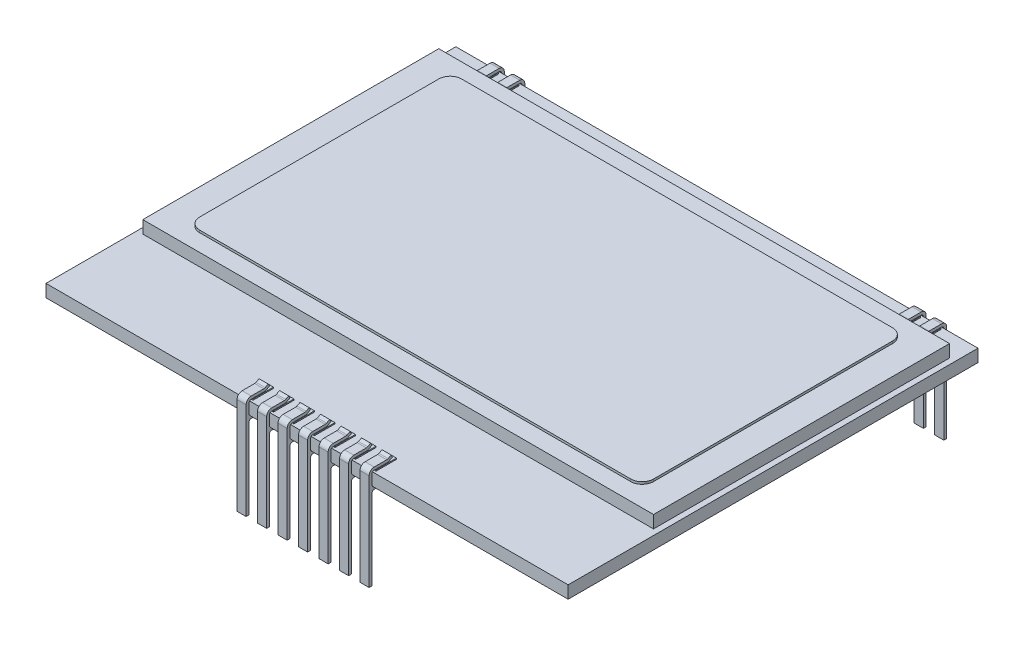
SolidWorks part; units mm, degrees
ref_plane "Front" through (0, 0, 0) normal (0, 0, 1) x (1, 0, 0)
ref_plane "Top" through (0, 0, 0) normal (0, 1, 0) x (1, 0, 0)
ref_plane "Right" through (0, 0, 0) normal (1, 0, 0) x (0, 0, -1)
sketch "Эскиз1" plane through (0, 0, 0) normal (0, 1, 0) x (1, 0, 0)
  line L1 (-22.93, -18) -> (22.93, -18)
  line L2 (-22.93, -18) -> (-22.93, 18)
  line L3 (-22.93, 18) -> (22.93, 18)
  line L4 (22.93, -18) -> (22.93, 18)
  line L5 (-22.93, -18) -> (22.93, 18) construction
  line L6 (-22.93, 18) -> (22.93, -18) construction
  point P0 (0, 0)
  dimension "D1" = 45.86
  dimension "D2" = 36
extrude "Вытянуть1" add sketch "Эскиз1" along normal blind 1.1 from offset 5
sketch "Эскиз2" plane through (0, 6.1, 0) normal (0, 1, 0) x (1, 0, 0)
  line L0 (-22.93, 18) -> (-22.93, -18) construction
  line L1 (22.43, -10) -> (-22.43, -10)
  line L2 (22.43, -10) -> (22.43, 16)
  line L3 (22.43, 16) -> (-22.43, 16)
  line L4 (-22.43, -10) -> (-22.43, 16)
  line L5 (22.43, -10) -> (-22.43, 16) construction
  line L6 (22.43, 16) -> (-22.43, -10) construction
  line L7 (-22.93, -18) -> (22.93, -18) construction
  point P0 (0, 3)
  dimension "D1" = 0.5
  dimension "D2" = 26
  dimension "D3" = 8
extrude "Вытянуть2" add sketch "Эскиз2" along normal blind 1.1
sketch "Эскиз3" plane through (0, 7.2, 0) normal (0, 1, 0) x (1, 0, 0)
  line L1 (-18.93, 14.5) -> (18.93, 14.5)
  line L2 (-19.93, 13.5) -> (-19.93, -7.5)
  line L3 (-18.93, -8.5) -> (18.93, -8.5)
  line L4 (19.93, 13.5) -> (19.93, -7.5)
  line L5 (-19.93, 14.5) -> (19.93, -8.5) construction
  line L6 (-19.93, -8.5) -> (19.93, 14.5) construction
  arc A0 (-18.93, 14.5) -> (-19.93, 13.5) centre (-18.93, 13.5) ccw
  arc A1 (18.93, 14.5) -> (19.93, 13.5) centre (18.93, 13.5) cw
  arc A2 (18.93, -8.5) -> (19.93, -7.5) centre (18.93, -7.5) ccw
  arc A3 (-19.93, -7.5) -> (-18.93, -8.5) centre (-18.93, -7.5) ccw
  point P0 (0, 3)
  dimension "D3" = 1
  dimension "D1" = 39.86
  dimension "D2" = 23
extrude "Вытянуть3" add sketch "Эскиз3" along normal blind 0.2
sketch "Эскиз4" plane through (0, 6.1, 0) normal (0, 1, 0) x (1, 0, 0)
  line L1 (-19.43, 16) -> (-19.43, 17.8) construction
  line L2 (-22.93, 18) -> (-22.93, -18) construction
  line L3 (-5.4, -17.8) -> (-5.4, -16) construction
  line L4 (-22.93, -18) -> (22.93, -18) construction
  line L5 (22.43, 16) -> (-22.43, 16) construction
  line L6 (-5.85, -17.8) -> (-4.95, -17.8)
  line L7 (-5.85, -17.8) -> (-5.85, -16)
  line L8 (-5.85, -16) -> (-4.95, -16)
  line L9 (-4.95, -17.8) -> (-4.95, -16)
  line L10 (-19.88, 16) -> (-18.98, 16)
  line L11 (-19.88, 16) -> (-19.88, 17.8)
  line L12 (-19.88, 17.8) -> (-18.98, 17.8)
  line L13 (-18.98, 16) -> (-18.98, 17.8)
  line L14 (22.93, 18) -> (-22.93, 18) construction
  line L15 (-3.15, -17.8) -> (-3.15, -16)
  line L16 (-4.05, -16) -> (-3.15, -16)
  line L17 (-4.05, -17.8) -> (-4.05, -16)
  line L18 (-4.05, -17.8) -> (-3.15, -17.8)
  line L19 (-1.35, -17.8) -> (-1.35, -16)
  line L20 (-2.25, -16) -> (-1.35, -16)
  line L21 (-2.25, -17.8) -> (-2.25, -16)
  line L22 (-2.25, -17.8) -> (-1.35, -17.8)
  line L23 (0.45, -17.8) -> (0.45, -16)
  line L24 (-0.45, -16) -> (0.45, -16)
  line L25 (-0.45, -17.8) -> (-0.45, -16)
  line L26 (-0.45, -17.8) -> (0.45, -17.8)
  line L27 (2.25, -17.8) -> (2.25, -16)
  line L28 (1.35, -16) -> (2.25, -16)
  line L29 (1.35, -17.8) -> (1.35, -16)
  line L30 (1.35, -17.8) -> (2.25, -17.8)
  line L31 (4.05, -17.8) -> (4.05, -16)
  line L32 (3.15, -16) -> (4.05, -16)
  line L33 (3.15, -17.8) -> (3.15, -16)
  line L34 (3.15, -17.8) -> (4.05, -17.8)
  line L35 (5.85, -17.8) -> (5.85, -16)
  line L36 (4.95, -16) -> (5.85, -16)
  line L37 (4.95, -17.8) -> (4.95, -16)
  line L38 (4.95, -17.8) -> (5.85, -17.8)
  line L39 (-18.08, 16) -> (-18.08, 17.8)
  line L41 (-18.08, 16) -> (-17.18, 16)
  line L42 (-18.08, 17.8) -> (-17.18, 17.8)
  line L43 (-17.18, 16) -> (-17.18, 17.8)
  line L44 (17.18, 16) -> (18.08, 16)
  line L45 (17.18, 16) -> (17.18, 17.8)
  line L46 (17.18, 17.8) -> (18.08, 17.8)
  line L47 (18.08, 16) -> (18.08, 17.8)
  line L48 (18.98, 16) -> (18.98, 17.8)
  line L49 (18.98, 16) -> (19.88, 16)
  line L50 (18.98, 17.8) -> (19.88, 17.8)
  line L51 (19.88, 16) -> (19.88, 17.8)
  line L52 (17.63, 16) -> (17.63, 17.8) construction
  line L53 (22.43, 16) -> (-22.43, 16) construction
  line L54 (5.4, -17.8) -> (5.4, -16) construction
  line L55 (22.93, -18) -> (22.93, 18) construction
  line L56 (19.43, 17.8) -> (19.43, 16) construction
  dimension "D1" = 0.9
  dimension "D2" = 1.8
  dimension "D3" = 3.5
  dimension "D4" = 17.53
  dimension "D5" = 0.2
  dimension "D6" = 0.2
  dimension "D7" = 1.8
  dimension "D8" = 1.8
  dimension "D9" = 35.26
  dimension "D10" = 17.53
  dimension "D11" = 3.5
extrude "Вытянуть4" add sketch "Эскиз4" along normal blind 0.1
sketch "Эскиз5" plane through (0, 0, 0) normal (1, 0, 0) x (0, 0, -1)
  line L0 (-18.1, 5.2) -> (-18.1, 6)
  line L1 (-17.9, 6.2) -> (-16.8, 6.2)
  line L2 (-16.5647, 6.2588) -> (-16.3, 6.4)
  line L3 (-18.1, 5.6) -> (-17.2147, 5.6) construction
  line L4 (-16.5647, 4.9412) -> (-16.3, 4.8)
  line L5 (-17.9, 5) -> (-16.8, 5)
  line L6 (-16, 6.2) -> (-16, 6.1) construction
  line L7 (-16, 6.2) -> (-16, 6.1) construction
  line L8 (-17.8, 6.2) -> (-16, 6.2) construction
  line L9 (-18, 5) -> (18, 5) construction
  line L10 (-18, 6.1) -> (-18, 5) construction
  line L11 (-16.6824, 4.7206) -> (-16.4176, 4.5794)
  line L12 (-17.9, 4.75) -> (-16.8, 4.75)
  line L13 (-18.35, 5.2) -> (-18.35, 6)
  line L14 (-17.9, 6.45) -> (-16.8, 6.45)
  line L15 (-16.6824, 6.4794) -> (-16.4176, 6.6206)
  line L16 (-16.3, 6.4) -> (-16.4176, 6.6206)
  line L17 (-16.4176, 4.5794) -> (-16.3, 4.8)
  line L18 (-18.35, 5.2) -> (-18.35, -2.5)
  line L19 (-18.35, -2.5) -> (-18.1, -2.5)
  line L20 (-18.1, -2.5) -> (-18.1, 4.55)
  line L21 (-17.9, 4.75) -> (-16.8, 4.75) construction
  arc A0 (-16.8, 6.2) -> (-16.5647, 6.2588) centre (-16.8, 6.7) ccw
  arc A1 (-18.1, 6) -> (-17.9, 6.2) centre (-17.9, 6) cw
  arc A2 (-18.1, 5.2) -> (-17.9, 5) centre (-17.9, 5.2) ccw
  arc A3 (-16.8, 5) -> (-16.5647, 4.9412) centre (-16.8, 4.5) cw
  arc A4 (-16.8, 4.75) -> (-16.6824, 4.7206) centre (-16.8, 4.5) cw
  arc A5 (-17.9, 4.75) -> (-18.1, 4.55) centre (-17.9, 4.55) ccw
  arc A6 (-18.35, 6) -> (-17.9, 6.45) centre (-17.9, 6) cw
  arc A7 (-16.8, 6.45) -> (-16.6824, 6.4794) centre (-16.8, 6.7) ccw
  arc A9 (-18.35, 5.2) -> (-17.9, 4.75) centre (-17.9, 5.2) ccw construction
  dimension "D1" = 0.5
  dimension "D2" = 0.2
  dimension "D8" = 0.2
  dimension "D3" = 0.3
  dimension "D4" = 0.2
  dimension "D5" = 0.8
  dimension "D6" = 0.1
  dimension "D9" = 7.5
  dimension "D7" = 0.25
extrude "Вытянуть5" add sketch "Эскиз5" along normal mid plane 0.8 from offset 5.4
sketch "Эскиз6" plane through (0, 0, 0) normal (1, 0, 0) x (0, 0, -1)
  line L0 (0, 0) -> (0, 5) construction
  line L1 (-18, 5) -> (18, 5) construction
  line L2 (18.1, -2.5) -> (18.1, 4.55)
  line L3 (18.35, -2.5) -> (18.1, -2.5)
  line L4 (18.35, 5.2) -> (18.35, -2.5)
  line L5 (18.35, 6) -> (18.35, 5.2)
  line L6 (16.8, 6.45) -> (17.9, 6.45)
  line L7 (16.4176, 6.6206) -> (16.6824, 6.4794)
  line L8 (16.3, 6.4) -> (16.4176, 6.6206)
  line L9 (16.5647, 6.2588) -> (16.3, 6.4)
  line L10 (17.9, 6.2) -> (16.8, 6.2)
  line L11 (18.1, 5.2) -> (18.1, 6)
  line L12 (16.8, 5) -> (17.9, 5)
  line L13 (16.3, 4.8) -> (16.5647, 4.9412)
  line L14 (16.4176, 4.5794) -> (16.3, 4.8)
  line L15 (16.6824, 4.7206) -> (16.4176, 4.5794)
  line L16 (17.9, 4.75) -> (16.8, 4.75)
  line L17 (-17.9, 4.75) -> (-16.8, 4.75)
  line L18 (-16.6824, 4.7206) -> (-16.4176, 4.5794)
  line L19 (-16.4176, 4.5794) -> (-16.3, 4.8)
  line L20 (-16.3, 4.8) -> (-16.5647, 4.9412)
  line L21 (-16.8, 5) -> (-17.9, 5)
  line L22 (-18.1, 5.2) -> (-18.1, 6)
  line L23 (-17.9, 6.2) -> (-16.8, 6.2)
  line L24 (-16.5647, 6.2588) -> (-16.3, 6.4)
  line L25 (-16.3, 6.4) -> (-16.4176, 6.6206)
  line L26 (-16.4176, 6.6206) -> (-16.6824, 6.4794)
  line L27 (-16.8, 6.45) -> (-17.9, 6.45)
  line L28 (-18.35, 6) -> (-18.35, 5.2)
  line L29 (-18.35, 5.2) -> (-18.35, -2.5)
  line L30 (-18.35, -2.5) -> (-18.1, -2.5)
  line L31 (-18.1, -2.5) -> (-18.1, 4.55)
  line L32 (-17.9, 4.75) -> (-16.8, 4.75) construction
  line L33 (-16.6824, 4.7206) -> (-16.4176, 4.5794) construction
  line L34 (-16.4176, 4.5794) -> (-16.3, 4.8) construction
  line L35 (-16.3, 4.8) -> (-16.5647, 4.9412) construction
  line L36 (-16.8, 5) -> (-17.9, 5) construction
  line L37 (-18.1, 5.2) -> (-18.1, 6) construction
  line L38 (-17.9, 6.2) -> (-16.8, 6.2) construction
  line L39 (-16.5647, 6.2588) -> (-16.3, 6.4) construction
  line L40 (-16.3, 6.4) -> (-16.4176, 6.6206) construction
  line L41 (-16.4176, 6.6206) -> (-16.6824, 6.4794) construction
  line L42 (-16.8, 6.45) -> (-17.9, 6.45) construction
  line L43 (-18.35, 6) -> (-18.35, 5.2) construction
  line L44 (-18.35, 5.2) -> (-18.35, -2.5) construction
  line L45 (-18.35, -2.5) -> (-18.1, -2.5) construction
  line L46 (-18.1, -2.5) -> (-18.1, 4.55) construction
  arc A0 (17.9, 4.75) -> (18.1, 4.55) centre (17.9, 4.55) cw
  arc A1 (17.9, 6.45) -> (18.35, 6) centre (17.9, 6) cw
  arc A2 (16.8, 6.45) -> (16.6824, 6.4794) centre (16.8, 6.7) cw
  arc A3 (16.8, 6.2) -> (16.5647, 6.2588) centre (16.8, 6.7) cw
  arc A4 (17.9, 6.2) -> (18.1, 6) centre (17.9, 6) cw
  arc A5 (18.1, 5.2) -> (17.9, 5) centre (17.9, 5.2) cw
  arc A6 (16.5647, 4.9412) -> (16.8, 5) centre (16.8, 4.5) cw
  arc A7 (16.6824, 4.7206) -> (16.8, 4.75) centre (16.8, 4.5) cw
  arc A8 (-16.6824, 4.7206) -> (-16.8, 4.75) centre (-16.8, 4.5) ccw
  arc A9 (-16.5647, 4.9412) -> (-16.8, 5) centre (-16.8, 4.5) ccw
  arc A10 (-18.1, 5.2) -> (-17.9, 5) centre (-17.9, 5.2) ccw
  arc A11 (-17.9, 6.2) -> (-18.1, 6) centre (-17.9, 6) ccw
  arc A12 (-16.8, 6.2) -> (-16.5647, 6.2588) centre (-16.8, 6.7) ccw
  arc A13 (-16.8, 6.45) -> (-16.6824, 6.4794) centre (-16.8, 6.7) ccw
  arc A14 (-17.9, 6.45) -> (-18.35, 6) centre (-17.9, 6) ccw
  arc A15 (-17.9, 4.75) -> (-18.1, 4.55) centre (-17.9, 4.55) ccw
  arc A16 (-16.6824, 4.7206) -> (-16.8, 4.75) centre (-16.8, 4.5) ccw construction
  arc A17 (-16.5647, 4.9412) -> (-16.8, 5) centre (-16.8, 4.5) ccw construction
  arc A18 (-18.1, 5.2) -> (-17.9, 5) centre (-17.9, 5.2) ccw construction
  arc A19 (-17.9, 6.2) -> (-18.1, 6) centre (-17.9, 6) ccw construction
  arc A20 (-16.8, 6.2) -> (-16.5647, 6.2588) centre (-16.8, 6.7) ccw construction
  arc A21 (-16.8, 6.45) -> (-16.6824, 6.4794) centre (-16.8, 6.7) ccw construction
  arc A22 (-17.9, 6.45) -> (-18.35, 6) centre (-17.9, 6) ccw construction
  arc A23 (-17.9, 4.75) -> (-18.1, 4.55) centre (-17.9, 4.55) ccw construction
  dimension "D1" = 0
extrude "Вытянуть6" add sketch "Эскиз6" along normal mid plane 0.8 from offset 19.43
pattern_linear "Линейный массив1" count 7 spacing 1.8 along (-1, 0, 0) of "Вытянуть5"
pattern_linear "Линейный массив2" count 2 spacing 1.8 along (-1, 0, 0) of "Вытянуть6"
pattern_linear "Линейный массив3" count 2 spacing 37.06 along (-1, 0, 0) of "Вытянуть6", "Линейный массив2"
